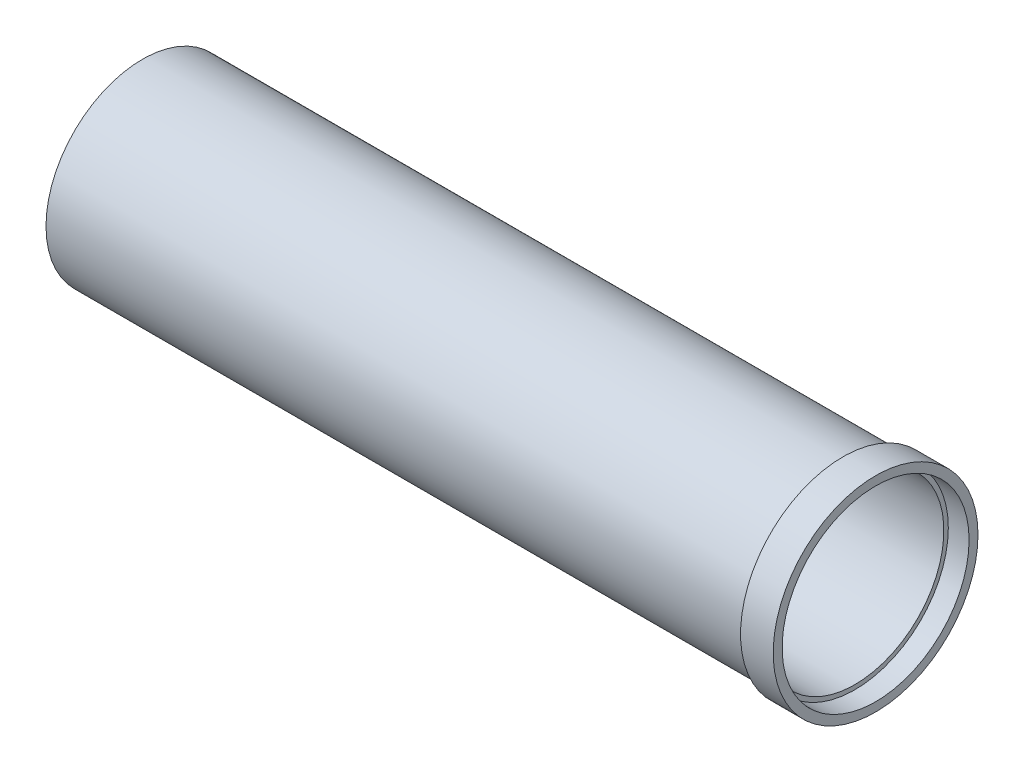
SolidWorks part; units mm, degrees
ref_plane "Front Plane" through (0, 0, 0) normal (0, 0, 1) x (1, 0, 0)
ref_plane "Top Plane" through (0, 0, 0) normal (0, 1, 0) x (1, 0, 0)
ref_plane "Right Plane" through (0, 0, 0) normal (1, 0, 0) x (0, 0, -1)
sketch "Sketch1" plane through (0, 0, 0) normal (1, 0, 0) x (0, 0, -1)
  circle A0 centre (0, 0) radius 38.1
  dimension "D1" = 76.2
extrude "Extrude-Thin1" add sketch "Sketch1" along normal mid plane 304.8 thin
sketch "Sketch2" plane through (152.4, 0, 0) normal (1, 0, 0) x (0, 0, -1)
  circle A1 centre (0, 0) radius 40.005
  circle A2 centre (0, 0) radius 43.815
  circle A3 centre (0, 0) radius 43.815
  circle A9 centre (0, 0) radius 41.275 construction
  dimension "D2" = 1.27
  dimension "D1" = 2.54
extrude "Extrude2" add sketch "Sketch2" along normal blind 8.89 and the other way blind 5.08
